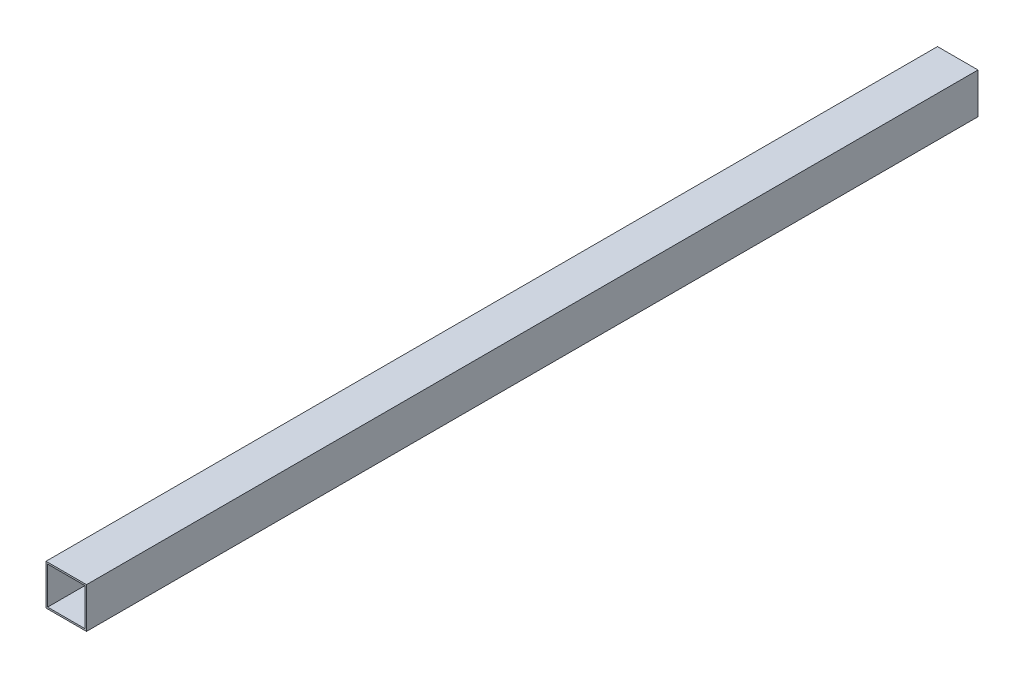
SolidWorks part; units mm, degrees
ref_plane "Piano frontale" through (0, 0, 0) normal (0, 0, 1) x (1, 0, 0)
ref_plane "Piano superiore" through (0, 0, 0) normal (0, 1, 0) x (1, 0, 0)
ref_plane "Piano destro" through (0, 0, 0) normal (1, 0, 0) x (0, 0, -1)
sketch "Schizzo1" plane through (0, 0, 0) normal (0, 0, 1) x (1, 0, 0)
  line L1 (-25, -25) -> (25, -25)
  line L2 (-25, -25) -> (-25, 25)
  line L3 (-25, 25) -> (25, 25)
  line L4 (25, -25) -> (25, 25)
  line L5 (-25, -25) -> (25, 25) construction
  line L6 (-25, 25) -> (25, -25) construction
  point P0 (0, 0)
  dimension "D1" = 50
  dimension "D2" = 50
extrude "Estrusione-Sottile1" add sketch "Schizzo1" along normal blind 1100 thin
